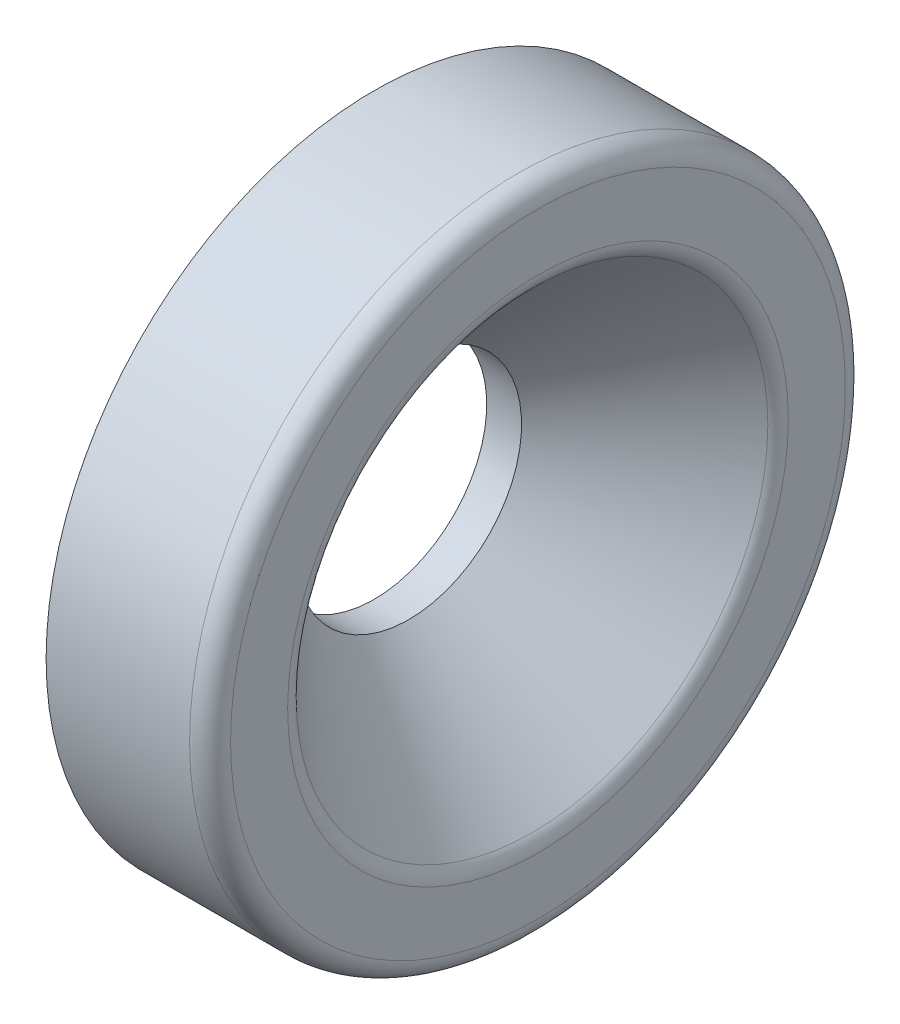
SolidWorks part; units mm, degrees
ref_plane "Plan1" through (0, 0, 0) normal (0, 0, 1) x (1, 0, 0)
ref_plane "Plan2" through (0, 0, 0) normal (0, 1, 0) x (1, 0, 0)
ref_plane "Plan3" through (0, 0, 0) normal (1, 0, 0) x (0, 0, -1)
sketch "Esquisse1" plane through (0, 0, 0) normal (0, 0, 1) x (1, 0, 0)
  line L0 (0, 0) -> (40.7973, 0) construction
  line L1 (0, 2.75) -> (0, 8)
  line L2 (0, 8) -> (4, 8)
  line L3 (4, 8) -> (4, 5.9)
  line L4 (4, 5.9) -> (0.85, 2.75)
  line L5 (0.85, 2.75) -> (0, 2.75)
  dimension "D1" = 5.5
  dimension "D2" = 45
  dimension "D3" = 11.8
  dimension "D4" = 16
  dimension "D5" = 4
revolve "Base-Révolution" add sketch "Esquisse1" angle 360 about L0
fillet "Congé1" radius 0.5 2 edges at (4, 0, 8) (4, 0, 5.9)
